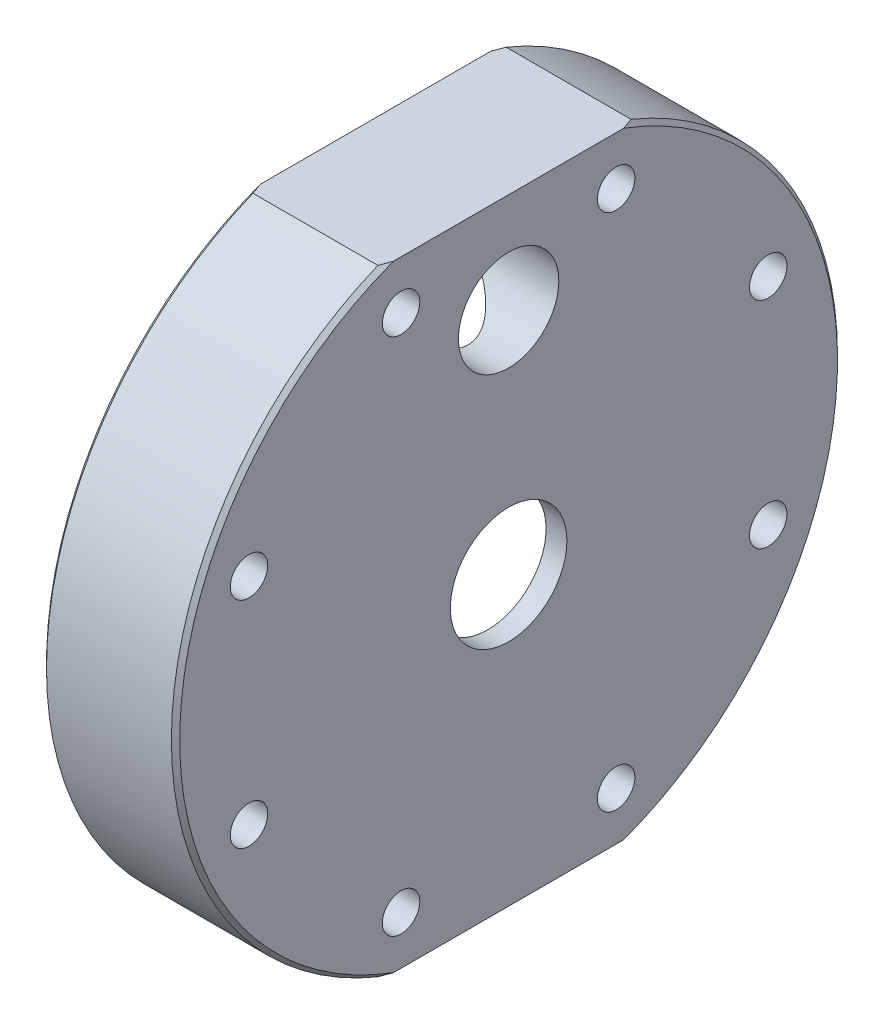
SolidWorks part; units mm, degrees
ref_plane "Face" through (0, 0, 0) normal (0, 0, 1) x (1, 0, 0)
ref_plane "Dessus" through (0, 0, 0) normal (0, 1, 0) x (1, 0, 0)
ref_plane "Droite" through (0, 0, 0) normal (1, 0, 0) x (0, 0, -1)
sketch "Esquisse1" plane through (0, 0, 0) normal (0, 0, 1) x (1, 0, 0)
  line L0 (29.3711, 2.7902) -> (29.3711, 36.0375)
  line L1 (2.3711, 82.7902) -> (34.3711, 82.7902)
  line L2 (2.3711, 82.7902) -> (2.3711, 63.0375)
  line L3 (34.3711, 2.7902) -> (29.3711, 2.7902)
  line L4 (34.3711, 82.7902) -> (34.3711, 2.7902)
  line L5 (29.3711, 36.0375) -> (2.3711, 63.0375)
  line L6 (13.1045, 2.7902) -> (42.385, 2.7902) construction
  dimension "D1" = 32
  dimension "D2" = 27
  dimension "D5" = 160
revolve "Révolution1" add sketch "Esquisse1" angle 360 about L6
sketch "Esquisse2" plane through (34.3711, 0, 0) normal (1, 0, 0) x (0, 0, -1)
  line L1 (-50.3104, 102.9935) -> (51.6206, 102.9935)
  line L2 (-50.3104, 102.9935) -> (-50.3104, 76.7902)
  line L3 (-50.3104, 76.7902) -> (51.6206, 76.7902)
  line L4 (51.6206, 102.9935) -> (51.6206, 76.7902)
  line L5 (-71.0111, -71.2098) -> (80.7063, -71.2098)
  line L6 (-71.0111, -71.2098) -> (-71.0111, -102.3918)
  line L7 (-71.0111, -102.3918) -> (80.7063, -102.3918)
  line L8 (80.7063, -71.2098) -> (80.7063, -102.3918)
  circle A1 centre (0, 2.7902) radius 80 construction
  dimension "D1" = 74
  dimension "D2" = 74
extrude "Enlèv. mat.-Extru.1" cut sketch "Esquisse2" against normal through all
sketch "Esquisse3" plane through (34.3711, 0, 0) normal (1, 0, 0) x (0, 0, -1)
  line L0 (0, 2.7902) -> (0, 113.8834) construction
  line L1 (0, 2.7902) -> (-42.2143, 104.7045) construction
  circle A0 centre (-25.8311, 65.152) radius 4.5
  arc A2 (30.3974, -71.2098) -> (30.3974, 76.7902) centre (0, 2.7902) ccw construction
  circle A3 centre (25.8311, 65.152) radius 4.5
  circle A4 centre (62.3619, 28.6213) radius 4.5
  circle A5 centre (62.3619, -23.041) radius 4.5
  circle A6 centre (25.8311, -59.5717) radius 4.5
  circle A7 centre (-25.8311, -59.5717) radius 4.5
  circle A8 centre (-62.3619, -23.041) radius 4.5
  circle A10 centre (-62.3619, 28.6213) radius 4.5
  dimension "D1" = 22.5
  dimension "D3" = 67.5
  dimension "D2" = 9
extrude "Enlèv. mat.-Extru.2" cut sketch "Esquisse3" against normal through all
sketch "Esquisse4" plane through (34.3711, 0, 0) normal (1, 0, 0) x (0, 0, -1)
  line L0 (0, 2.7902) -> (0, 56.3564) construction
  circle A0 centre (0, 52.7902) radius 12.0585
  arc A2 (30.3974, -71.2098) -> (30.3974, 76.7902) centre (0, 2.7902) ccw construction
  circle A3 centre (0, -2.2098) radius 14
  dimension "D1" = 50
  dimension "D2" = 24.117
  dimension "D3" = 5
  dimension "D4" = 28
extrude "Enlèv. mat.-Extru.3" cut sketch "Esquisse4" against normal through all
chamfer "Chanfrein1" distance 1 angle 45 4 edges at (2.3711, 2.7902, -80) (2.3711, 2.7902, 80) (34.3711, 2.7902, 80) (34.3711, 2.7902, -80)
